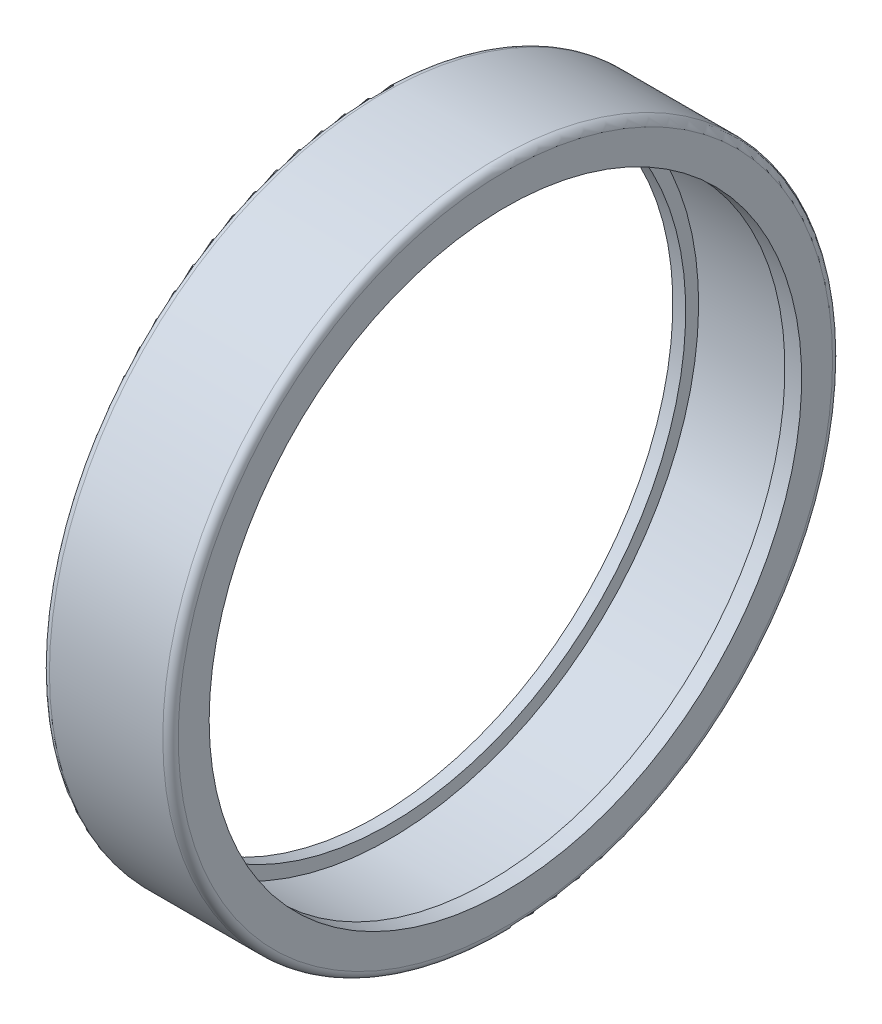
SolidWorks part; units mm, degrees
ref_plane "Plane1" through (0, 0, 0) normal (0, 0, 1) x (1, 0, 0)
ref_plane "Plane2" through (0, 0, 0) normal (0, 1, 0) x (1, 0, 0)
ref_plane "Plane3" through (0, 0, 0) normal (1, 0, 0) x (0, 0, -1)
sketch "Esquisse1" plane through (0, 0, 0) normal (0, 0, 1) x (1, 0, 0)
  line L0 (0, 13) -> (5, 13)
  line L1 (5, 13) -> (5, 11.5)
  line L2 (5, 11.5) -> (4.35, 11.5)
  line L3 (4.35, 11.5) -> (4.35, 12)
  line L4 (4.35, 12) -> (0.5, 12)
  line L5 (0.5, 12) -> (0.5, 11.5)
  line L6 (0.5, 11.5) -> (0, 11.5)
  line L7 (0, 11.5) -> (0, 13)
  line L8 (-1.85, 0) -> (7.9, 0) construction
revolve "Base-Révolution" add sketch "Esquisse1" angle 360 about L8
fillet "Congé1" radius 0.3
sketch "Esquisse2" plane through (0, 0, 0) normal (-1, 0, 0) x (0, 0, 1)
  text T0 "S K F" font "Copperplate Gothic Bold" height 1.5
  point P1 (0, 0)
extrude "Enlèv. mat.-Extru.1" cut sketch "Esquisse2" against normal blind 0.5
